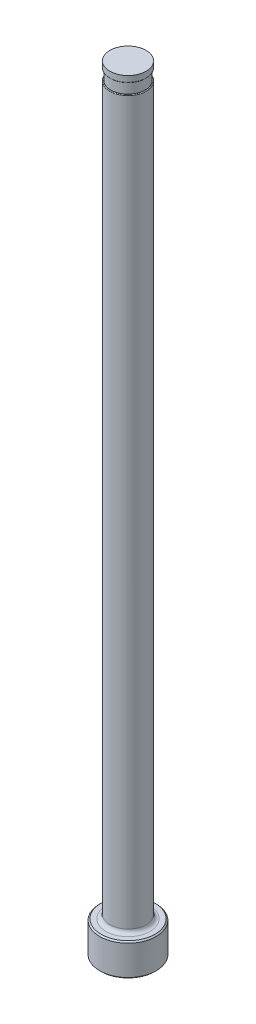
SolidWorks part; units mm, degrees
ref_plane "Front Plane" through (0, 0, 0) normal (0, 0, 1) x (1, 0, 0)
ref_plane "Top Plane" through (0, 0, 0) normal (0, 1, 0) x (1, 0, 0)
ref_plane "Right Plane" through (0, 0, 0) normal (1, 0, 0) x (0, 0, -1)
other "Configuration Table"
sketch "Sketch1" plane through (0, 0, 0) normal (0, 0, 1) x (1, 0, 0)
  line L0 (0, 259.9588) -> (0, -15.1925) construction
  line L1 (0, 0) -> (-5.5499, 0)
  line L2 (-5.5499, 0) -> (-5.5499, 6.35)
  line L3 (-5.5499, 6.35) -> (-3.5712, 6.35)
  line L4 (-3.5712, 6.35) -> (-3.5712, 152.4)
  line L5 (-3.5712, 152.4) -> (0, 152.4)
  line L6 (0, 152.4) -> (0, 0)
  dimension "L" = 152.4
  dimension "H" = 11.0998
  dimension "T" = 6.35
  dimension "D" = 7.1425
revolve "Revolve1" add sketch "Sketch1" angle 360 about L0
chamfer "Chamfer1" distance 0.254 angle 45 2 edges at (0, 6.35, 5.5499) (0, 0, 5.5499)
fillet "Fillet1" radius 0.762 1 edges at (0, 6.35, 3.5712)
sketch "Sketch2" plane through (0, 0, 0) normal (0, 0, 1) x (1, 0, 0)
  line L0 (-3.5712, 152.4) -> (-3.5712, 7.112) construction
  line L1 (-3.5712, 151.13) -> (-3.368, 151.13)
  line L2 (-3.5712, 151.13) -> (-3.5712, 149.098)
  line L3 (-3.5712, 149.098) -> (-3.368, 149.098)
  line L4 (-3.368, 151.13) -> (-3.368, 149.098)
  line L5 (3.5712, 152.4) -> (-3.5712, 152.4) construction
  line L6 (0, 153.4483) -> (0, 147.3282) construction
  dimension "D1" = 2.032
  dimension "N" = 1.27
  dimension "FD" = 0.2032
  dimension "D3" = 6.7361
revolve "Vent Relief" cut sketch "Sketch2" angle 360 about L6
sketch "Sketch3" plane through (0, 0, 0) normal (0, 0, 1) x (1, 0, 0)
  line L0 (-3.368, 150.114) -> (-3.368, 86.614)
  line L1 (-3.368, 151.13) -> (-3.368, 149.098) construction
  line L2 (-3.5712, 149.098) -> (-3.5712, 7.112) construction
  line L3 (-3.5712, 85.4964) -> (-3.5712, 150.114)
  line L4 (-3.5712, 150.114) -> (-3.368, 150.114)
  arc A0 (-3.368, 86.614) -> (-3.5712, 85.4964) centre (-6.543, 86.614) cw
  dimension "D1" = 3.175
  dimension "D2" = 63.5
extrude "D-Slot" cut sketch "Sketch3" against normal through all both and the other way through all
sketch "Sketch5" plane through (0, 0, 0) normal (0, 0, 1) x (1, 0, 0)
  line L0 (-3.5712, 151.13) -> (3.5712, 151.13) construction
  line L1 (-3.5712, 152.4) -> (-3.5585, 152.4)
  line L2 (-3.5712, 152.4) -> (-3.5712, 151.13)
  line L3 (-3.5712, 151.13) -> (-3.5585, 151.13)
  line L4 (-3.5585, 152.4) -> (-3.5585, 151.13)
  line L5 (0, 152.6877) -> (0, 150.5771) construction
  dimension "VP" = 0.0127
revolve "Vent Diameter" cut sketch "Sketch5" angle 360 about L5
fillet "Fillet2" radius 0.127 2 edges at (3.5712, 149.098, 0) (0, 151.13, 3.5585)
sketch "Pocket Sketch" plane through (0, 0, 0) normal (0, 0, 1) x (1, 0, 0)
  line L0 (-5.9468, 0) -> (-5.9468, 6.3754)
  line L1 (-5.9468, 6.3754) -> (-4.5317, 6.3754)
  line L2 (-3.7697, 7.1374) -> (-3.7697, 22.225)
  line L3 (-3.7697, 22.225) -> (0, 22.225)
  line L4 (0, 22.225) -> (0, 0)
  line L5 (0, 0) -> (-5.9468, 0)
  line L6 (0, 12.6104) -> (0, -2.4989) construction
  line L7 (-5.5499, 6.096) -> (-5.5499, 0.254) construction
  line L8 (5.2959, 6.35) -> (-5.2959, 6.35) construction
  line L9 (-3.5712, 85.4964) -> (-3.5712, 7.112) construction
  line L10 (-4.5317, 6.3754) -> (-3.7697, 7.1374)
  point P3 (-3.7697, 6.3754)
  dimension "D1" = 11.8935
  dimension "D2" = 0.3969
  dimension "D3" = 0.0254
  dimension "D4" = 0.1984
  dimension "D5" = 7.5394
  dimension "D6" = 22.225
